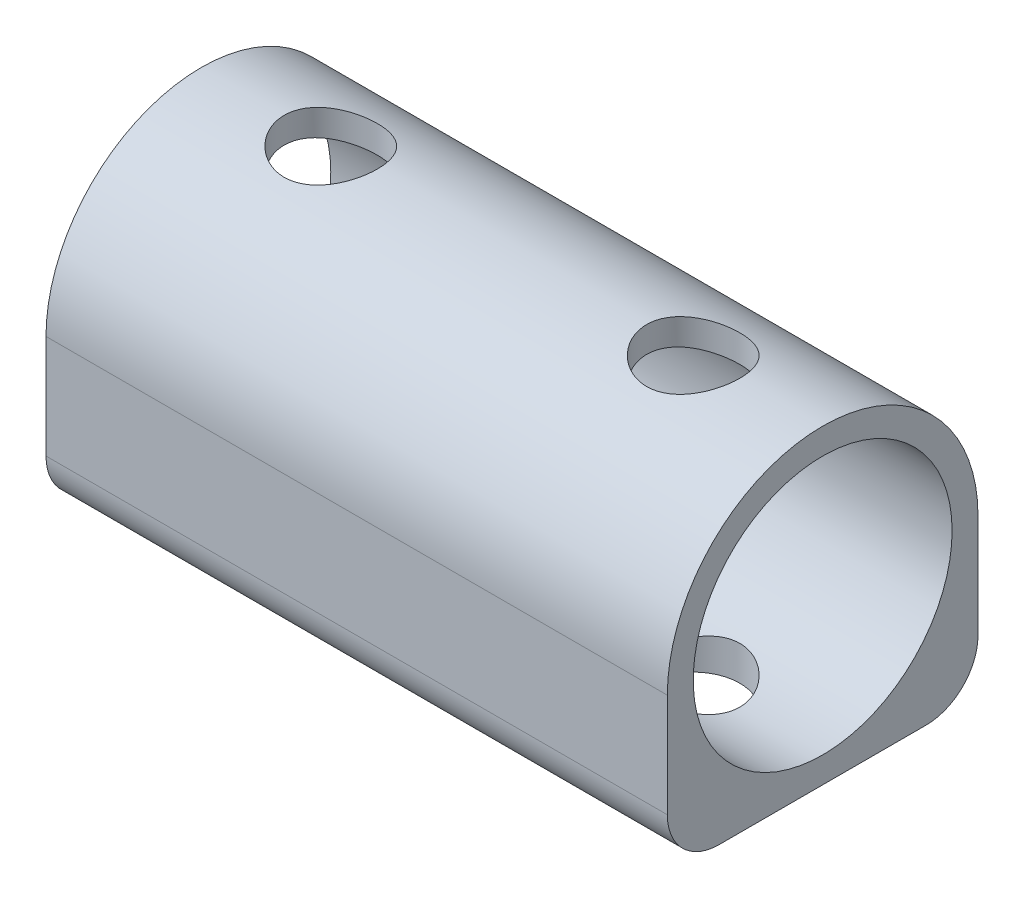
SolidWorks part; units mm, degrees
ref_plane "Front" through (0, 0, 0) normal (0, 0, 1) x (1, 0, 0)
ref_plane "Top" through (0, 0, 0) normal (0, 1, 0) x (1, 0, 0)
ref_plane "Right" through (0, 0, 0) normal (1, 0, 0) x (0, 0, -1)
sketch "Sketch1" plane through (0, 0, 0) normal (1, 0, 0) x (0, 0, -1)
  line L0 (19.05, 0) -> (19.05, -19.05)
  line L1 (-19.05, 0) -> (-19.05, -19.05)
  line L2 (-19.05, -19.05) -> (19.05, -19.05)
  arc A1 (19.05, 0) -> (-19.05, 0) centre (0, 0) ccw
  dimension "D4" = 19.05
  dimension "D5" = 38.1
extrude "Base-Extrude" add sketch "Sketch1" against normal blind 76.2
sketch "Sketch3" plane through (0, 0, 0) normal (1, 0, 0) x (0, 0, -1)
  circle A0 centre (0, 0) radius 15.875
  dimension "D1" = 31.75
extrude "Cut-Extrude2" cut sketch "Sketch3" against normal through all
sketch "Sketch2" plane through (0, -19.05, 0) normal (0, -1, 0) x (1, 0, 0)
  line L0 (-38.1, 0) -> (-38.1, -19.05) construction
  line L1 (-76.2, -19.05) -> (0, -19.05) construction
  line L3 (50, 0) -> (-50, 0) construction
  circle A0 centre (-15.875, 0) radius 5.715
  circle A1 centre (-60.325, 0) radius 5.715
  dimension "D1" = 44.45
  dimension "D2" = 11.43
extrude "Cut-Extrude1" cut sketch "Sketch2" against normal through all
fillet "Fillet1" radius 6.35 2 edges at (-38.1, -19.05, 19.05) (-38.1, -19.05, -19.05)
